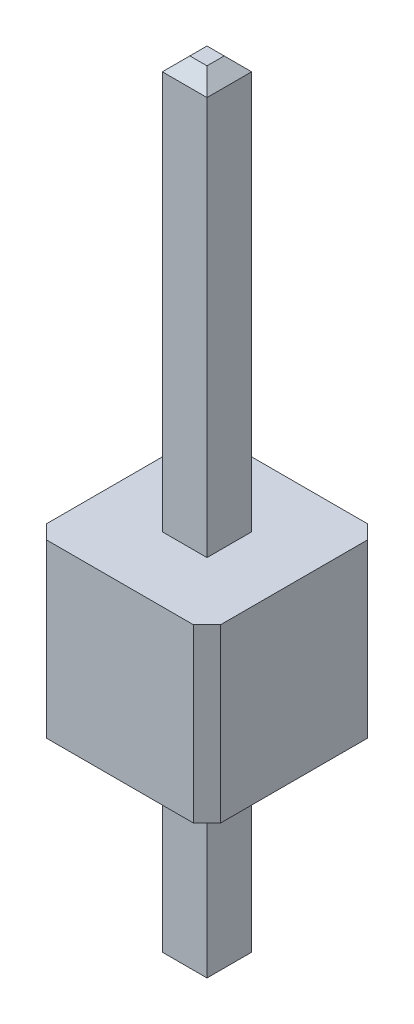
SolidWorks part; units mm, degrees
ref_plane "Front Plane" through (0, 0, 0) normal (0, 0, 1) x (1, 0, 0)
ref_plane "Top Plane" through (0, 0, 0) normal (0, 1, 0) x (1, 0, 0)
ref_plane "Right Plane" through (0, 0, 0) normal (1, 0, 0) x (0, 0, -1)
sketch "Sketch1" plane through (0, 0, 0) normal (0, 1, 0) x (1, 0, 0)
  line L1 (-1.27, -1.27) -> (1.27, -1.27)
  line L2 (-1.27, -1.27) -> (-1.27, 1.27)
  line L3 (-1.27, 1.27) -> (1.27, 1.27)
  line L4 (1.27, -1.27) -> (1.27, 1.27)
  line L5 (-1.27, -1.27) -> (1.27, 1.27) construction
  line L6 (-1.27, 1.27) -> (1.27, -1.27) construction
  point P0 (0, 0)
  dimension "D1" = 2.54
  dimension "D2" = 2.54
extrude "Boss-Extrude1" add sketch "Sketch1" along normal blind 2.5
sketch "Sketch2" plane through (0, 2.5, 0) normal (0, 1, 0) x (1, 0, 0)
  line L1 (-0.325, -0.325) -> (0.325, -0.325)
  line L2 (-0.325, -0.325) -> (-0.325, 0.325)
  line L3 (-0.325, 0.325) -> (0.325, 0.325)
  line L4 (0.325, -0.325) -> (0.325, 0.325)
  line L5 (-0.325, -0.325) -> (0.325, 0.325) construction
  line L6 (-0.325, 0.325) -> (0.325, -0.325) construction
  point P0 (0, 0)
  dimension "D1" = 0.65
  dimension "D2" = 0.65
extrude "Boss-Extrude2" add sketch "Sketch2" along normal blind 6 and the other way blind 5.5
chamfer "Chamfer1" distance 0.2 angle 45 4 edges at (-1.27, 1.25, -1.27) (1.27, 1.25, -1.27) (-1.27, 1.25, 1.27) (1.27, 1.25, 1.27)
chamfer "Chamfer2" distance 0.2 angle 45 8 edges at (0, 8.5, 0.325) (-0.325, 8.5, 0) (0, 8.5, -0.325) (0.325, 8.5, 0) (0, -3, 0.325) (-0.325, -3, 0) (0, -3, -0.325) (0.325, -3, 0)
